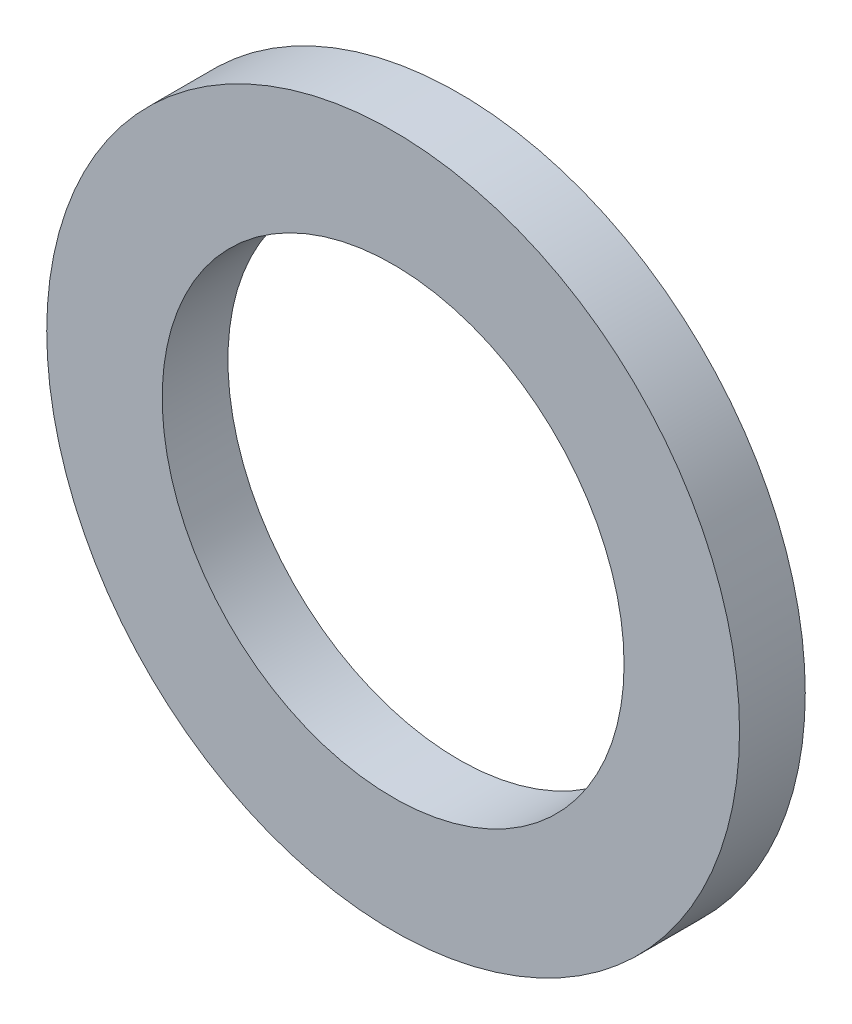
SolidWorks part; units mm, degrees
ref_plane "Plan de face" through (0, 0, 0) normal (0, 0, 1) x (1, 0, 0)
ref_plane "Plan de dessus" through (0, 0, 0) normal (0, 1, 0) x (1, 0, 0)
ref_plane "Plan de droite" through (0, 0, 0) normal (1, 0, 0) x (0, 0, -1)
sketch "Esquisse1" plane through (0, 0, 0) normal (0, 0, 1) x (1, 0, 0)
  circle A0 centre (0, 0) radius 19.5
  circle A1 centre (0, 0) radius 13
  dimension "D1" = 39
  dimension "D2" = 26
extrude "Extrusion1" add sketch "Esquisse1" along normal mid plane 3.7
sketch "Esquisse2" plane through (0, 0, 1.85) normal (0, 0, 1) x (1, 0, 0)
  line L1 (-26.844, 0) -> (28.0622, 0)
  line L2 (-26.844, 0) -> (-26.844, -21.4056)
  line L3 (-26.844, -21.4056) -> (28.0622, -21.4056)
  line L4 (28.0622, 0) -> (28.0622, -21.4056)
extrude "Enlèv. mat.-Extru.1" [suppressed] cut sketch "Esquisse2" against normal through all
